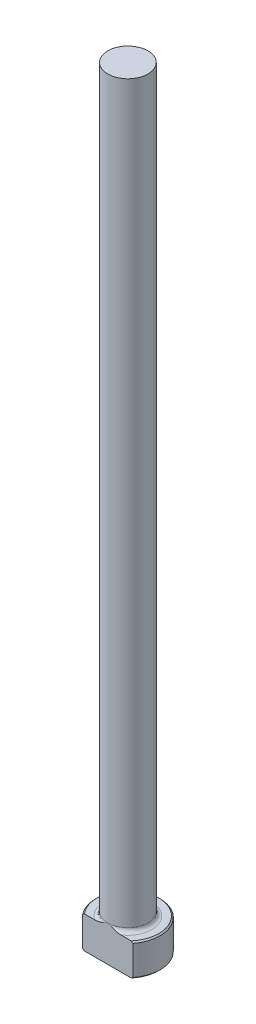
SolidWorks part; units mm, degrees
ref_plane "Front Plane" through (0, 0, 0) normal (0, 0, 1) x (1, 0, 0)
ref_plane "Top Plane" through (0, 0, 0) normal (0, 1, 0) x (1, 0, 0)
ref_plane "Right Plane" through (0, 0, 0) normal (1, 0, 0) x (0, 0, -1)
sketch "Sketch1" plane through (0, 0, 0) normal (0, 0, 1) x (1, 0, 0)
  line L0 (0, 259.9588) -> (0, -15.1925) construction
  line L1 (0, 0) -> (-6.35, 0)
  line L2 (-6.35, 0) -> (-6.35, 6.35)
  line L3 (-6.35, 6.35) -> (-3.9687, 6.35)
  line L4 (-3.9687, 6.35) -> (-3.9687, 152.4)
  line L5 (-3.9687, 152.4) -> (0, 152.4)
  line L6 (0, 152.4) -> (0, 0)
  dimension "L" = 152.4
  dimension "H" = 12.7
  dimension "T" = 6.35
  dimension "D" = 7.9375
revolve "Revolve1" add sketch "Sketch1" angle 360 about L0
chamfer "Chamfer1" distance 0.254 angle 45 2 edges at (0, 6.35, 6.35) (0, 0, 6.35)
fillet "Fillet1" radius 0.762 1 edges at (0, 6.35, 3.9687)
sketch "Sketch2" plane through (0, 0, 0) normal (0, -1, 0) x (1, 0, 0)
  line L0 (-4.957, 3.9687) -> (4.957, 3.9687)
  arc A0 (4.957, 3.9687) -> (-4.957, 3.9687) centre (0, 0) ccw
  circle A1 centre (0, 0) radius 6.35 construction
  circle A3 centre (0, 0) radius 3.9687 construction
extrude "KEY" cut sketch "Sketch2" against normal through all
sketch "Pocket Sketch" plane through (0, 0, 0) normal (0, 0, 1) x (1, 0, 0)
  line L0 (-6.7469, 0) -> (-6.7469, 6.3754)
  line L1 (-6.7469, 6.3754) -> (-5.1276, 6.3754)
  line L2 (-4.3656, 7.1374) -> (-4.3656, 22.225)
  line L3 (-4.3656, 22.225) -> (0, 22.225)
  line L4 (0, 22.225) -> (0, 0)
  line L5 (0, 0) -> (-6.7469, 0)
  line L6 (0, 12.6104) -> (0, -2.4989) construction
  line L7 (-6.35, 6.096) -> (-6.35, 0.254) construction
  line L8 (6.096, 6.35) -> (-6.096, 6.35) construction
  line L9 (-3.9687, 152.4) -> (-3.9687, 7.112) construction
  line L10 (-5.1276, 6.3754) -> (-4.3656, 7.1374)
  point P3 (-4.3656, 6.3754)
  dimension "D1" = 13.4937
  dimension "D2" = 0.3969
  dimension "D3" = 0.0254
  dimension "D4" = 0.3969
  dimension "D5" = 8.7312
  dimension "D6" = 22.225
